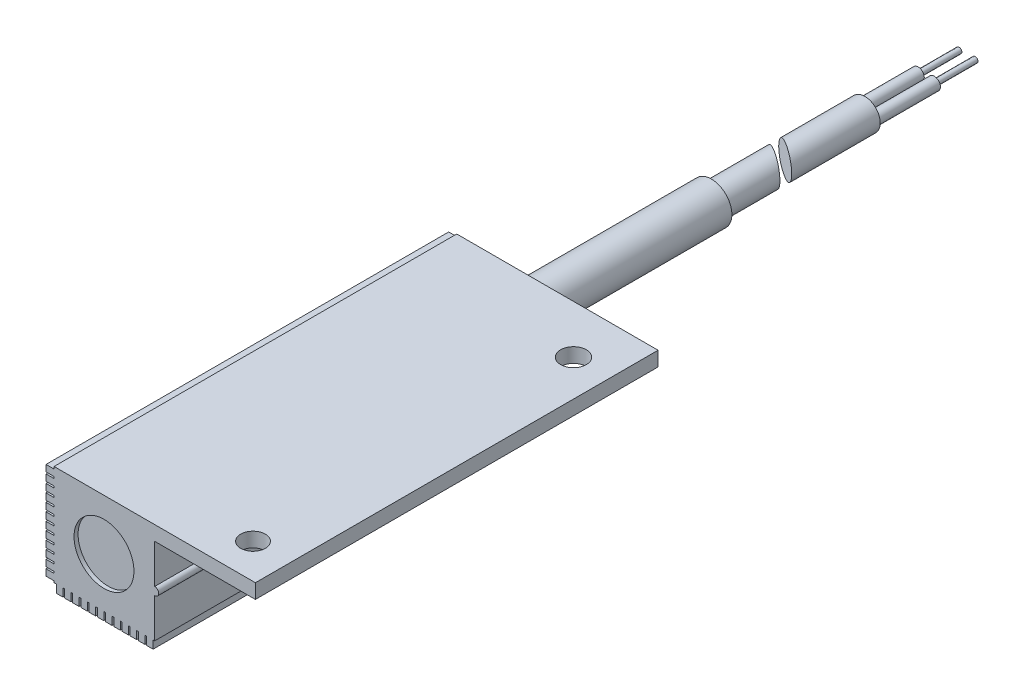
SolidWorks part; units mm, degrees
other "LUMP1"
other "LUMP2"
ref_plane "Спереди" through (0, 0, 0) normal (0, 0, 1) x (1, 0, 0)
ref_plane "Сверху" through (0, 0, 0) normal (0, 1, 0) x (1, 0, 0)
ref_plane "Справа" through (0, 0, 0) normal (1, 0, 0) x (0, 0, -1)
imported_body "Импортированный1"
imported_body "Импортированный2"
sketch "Эскиз2" plane through (0, 0, 6) normal (0, 0, 1) x (1, 0, 0)
  line L0 (4.608, -1.8) -> (-7.892, -1.8)
  line L1 (-7.892, -1.8) -> (-7.892, -12.5)
  line L2 (-7.892, -12.5) -> (-20.392, -12.5)
  line L3 (-20.392, -12.5) -> (-20.392, 0)
  line L4 (-20.392, 0) -> (4.608, 0) construction
  line L5 (-20.392, 0) -> (-20.392, -12.5) construction
  line L6 (-20.392, 0) -> (4.608, 0)
  line L7 (4.608, 0) -> (4.608, -1.8)
extrude "Бобышка-Вытянуть1" add sketch "Эскиз2" along normal blind 20
sketch "Эскиз3" plane through (0, -1.8, 0) normal (0, -1, 0) x (1, 0, 0)
  line L1 (2.5679, -2.1941) -> (-2.21, -2.1941)
  line L2 (2.5679, -2.1941) -> (2.5679, 2.1742)
  line L3 (2.5679, 2.1742) -> (-2.21, 2.1742)
  line L4 (-2.21, -2.1941) -> (-2.21, 2.1742)
extrude "Бобышка-Вытянуть2" add sketch "Эскиз3" against normal up to surface (1.8 mm away)
sketch "Эскиз4" plane through (0, -1.8, 0) normal (0, -1, 0) x (1, 0, 0)
  circle A0 centre (0, 21.6873) radius 1.5315
extrude "Вырез-Вытянуть1" cut sketch "Эскиз4" against normal up to surface (1.8 mm away)
sketch "Эскиз5" plane through (0, 0, 26) normal (0, 0, 1) x (1, 0, 0)
  line L0 (-20.392, -12.5) -> (-7.892, -12.5) construction
  line L1 (-8.092, -13.5) -> (-8.892, -13.5)
  line L2 (-8.092, -13.5) -> (-8.092, -12.5)
  line L3 (-8.092, -12.5) -> (-8.892, -12.5)
  line L4 (-8.892, -13.5) -> (-8.892, -12.5)
  line L6 (-7.892, -12.5) -> (-7.892, -1.8) construction
  line L7 (-9.112, -13.5) -> (-9.912, -13.5)
  line L8 (-9.112, -13.5) -> (-9.112, -12.5)
  line L9 (-9.112, -12.5) -> (-9.912, -12.5)
  line L10 (-9.912, -13.5) -> (-9.912, -12.5)
  line L11 (-10.132, -13.5) -> (-10.932, -13.5)
  line L12 (-10.132, -13.5) -> (-10.132, -12.5)
  line L13 (-10.132, -12.5) -> (-10.932, -12.5)
  line L14 (-10.932, -13.5) -> (-10.932, -12.5)
  line L15 (-11.152, -13.5) -> (-11.952, -13.5)
  line L16 (-11.152, -13.5) -> (-11.152, -12.5)
  line L17 (-11.152, -12.5) -> (-11.952, -12.5)
  line L18 (-11.952, -13.5) -> (-11.952, -12.5)
  line L19 (-12.172, -13.5) -> (-12.972, -13.5)
  line L20 (-12.172, -13.5) -> (-12.172, -12.5)
  line L21 (-12.172, -12.5) -> (-12.972, -12.5)
  line L22 (-12.972, -13.5) -> (-12.972, -12.5)
  line L23 (-13.192, -13.5) -> (-13.992, -13.5)
  line L24 (-13.192, -13.5) -> (-13.192, -12.5)
  line L25 (-13.192, -12.5) -> (-13.992, -12.5)
  line L26 (-13.992, -13.5) -> (-13.992, -12.5)
  line L27 (-14.212, -13.5) -> (-15.012, -13.5)
  line L28 (-14.212, -13.5) -> (-14.212, -12.5)
  line L29 (-14.212, -12.5) -> (-15.012, -12.5)
  line L30 (-15.012, -13.5) -> (-15.012, -12.5)
  line L31 (-15.232, -13.5) -> (-16.032, -13.5)
  line L32 (-15.232, -13.5) -> (-15.232, -12.5)
  line L33 (-15.232, -12.5) -> (-16.032, -12.5)
  line L34 (-16.032, -13.5) -> (-16.032, -12.5)
  line L35 (-16.252, -13.5) -> (-17.052, -13.5)
  line L36 (-16.252, -13.5) -> (-16.252, -12.5)
  line L37 (-16.252, -12.5) -> (-17.052, -12.5)
  line L38 (-17.052, -13.5) -> (-17.052, -12.5)
  line L39 (-17.272, -13.5) -> (-18.072, -13.5)
  line L40 (-17.272, -13.5) -> (-17.272, -12.5)
  line L41 (-17.272, -12.5) -> (-18.072, -12.5)
  line L42 (-18.072, -13.5) -> (-18.072, -12.5)
  line L43 (-18.292, -13.5) -> (-19.092, -13.5)
  line L44 (-18.292, -13.5) -> (-18.292, -12.5)
  line L45 (-18.292, -12.5) -> (-19.092, -12.5)
  line L46 (-19.092, -13.5) -> (-19.092, -12.5)
  line L47 (-19.312, -13.5) -> (-20.112, -13.5)
  line L48 (-19.312, -13.5) -> (-19.312, -12.5)
  line L49 (-19.312, -12.5) -> (-20.112, -12.5)
  line L50 (-20.112, -13.5) -> (-20.112, -12.5)
  line L51 (-8.092, -13.5) -> (-9.112, -13.5) construction
  line L52 (-20.392, 0) -> (-20.392, -12.5) construction
  line L53 (-20.392, -12.3) -> (-21.392, -12.3)
  line L54 (-20.392, -12.3) -> (-20.392, -11.5)
  line L55 (-20.392, -11.5) -> (-21.392, -11.5)
  line L56 (-21.392, -12.3) -> (-21.392, -11.5)
  line L57 (-20.392, -11.28) -> (-21.392, -11.28)
  line L58 (-20.392, -11.28) -> (-20.392, -10.48)
  line L59 (-20.392, -10.48) -> (-21.392, -10.48)
  line L60 (-21.392, -11.28) -> (-21.392, -10.48)
  line L61 (-20.392, -10.26) -> (-21.392, -10.26)
  line L62 (-20.392, -10.26) -> (-20.392, -9.46)
  line L63 (-20.392, -9.46) -> (-21.392, -9.46)
  line L64 (-21.392, -10.26) -> (-21.392, -9.46)
  line L65 (-20.392, -9.24) -> (-21.392, -9.24)
  line L66 (-20.392, -9.24) -> (-20.392, -8.44)
  line L67 (-20.392, -8.44) -> (-21.392, -8.44)
  line L68 (-21.392, -9.24) -> (-21.392, -8.44)
  line L69 (-20.392, -8.22) -> (-21.392, -8.22)
  line L70 (-20.392, -8.22) -> (-20.392, -7.42)
  line L71 (-20.392, -7.42) -> (-21.392, -7.42)
  line L72 (-21.392, -8.22) -> (-21.392, -7.42)
  line L73 (-20.392, -7.2) -> (-21.392, -7.2)
  line L74 (-20.392, -7.2) -> (-20.392, -6.4)
  line L75 (-20.392, -6.4) -> (-21.392, -6.4)
  line L76 (-21.392, -7.2) -> (-21.392, -6.4)
  line L77 (-20.392, -6.18) -> (-21.392, -6.18)
  line L78 (-20.392, -6.18) -> (-20.392, -5.38)
  line L79 (-20.392, -5.38) -> (-21.392, -5.38)
  line L80 (-21.392, -6.18) -> (-21.392, -5.38)
  line L81 (-20.392, -5.16) -> (-21.392, -5.16)
  line L82 (-20.392, -5.16) -> (-20.392, -4.36)
  line L83 (-20.392, -4.36) -> (-21.392, -4.36)
  line L84 (-21.392, -5.16) -> (-21.392, -4.36)
  line L85 (-20.392, -4.14) -> (-21.392, -4.14)
  line L86 (-20.392, -4.14) -> (-20.392, -3.34)
  line L87 (-20.392, -3.34) -> (-21.392, -3.34)
  line L88 (-21.392, -4.14) -> (-21.392, -3.34)
  line L89 (-20.392, -3.12) -> (-21.392, -3.12)
  line L90 (-20.392, -3.12) -> (-20.392, -2.32)
  line L91 (-20.392, -2.32) -> (-21.392, -2.32)
  line L92 (-21.392, -3.12) -> (-21.392, -2.32)
  line L93 (-20.392, -2.1) -> (-21.392, -2.1)
  line L94 (-20.392, -2.1) -> (-20.392, -1.3)
  line L95 (-20.392, -1.3) -> (-21.392, -1.3)
  line L96 (-21.392, -2.1) -> (-21.392, -1.3)
  line L97 (-20.392, -1.08) -> (-21.392, -1.08)
  line L98 (-20.392, -1.08) -> (-20.392, -0.28)
  line L99 (-20.392, -0.28) -> (-21.392, -0.28)
  line L100 (-21.392, -1.08) -> (-21.392, -0.28)
  line L101 (-20.392, -12.3) -> (-20.392, -11.28) construction
  circle A0 centre (-7.892, -7.15) radius 0.4981
  dimension "D1" = 0.8
  dimension "D2" = 1
  dimension "D3" = 0.2
  dimension "D5" = 1.02
  dimension "D6" = 0.8
  dimension "D7" = 1
  dimension "D8" = 0.2
  dimension "D10" = 1.02
  dimension "D4" = 12
  dimension "D9" = 12
extrude "Бобышка-Вытянуть3" add sketch "Эскиз5" against normal up to surface (50 mm away)
sketch "Эскиз6" plane through (0, 0, 26) normal (0, 0, 1) x (1, 0, 0)
  line L0 (-7.892, -6.6519) -> (-7.892, -1.8) construction
  line L1 (4.608, 0) -> (-20.392, 0) construction
  circle A0 centre (-14.192, -6.3) radius 3.7193
  dimension "D1" = 6.3
  dimension "D2" = 6.3
extrude "Вырез-Вытянуть2" cut sketch "Эскиз6" against normal blind 0.5
